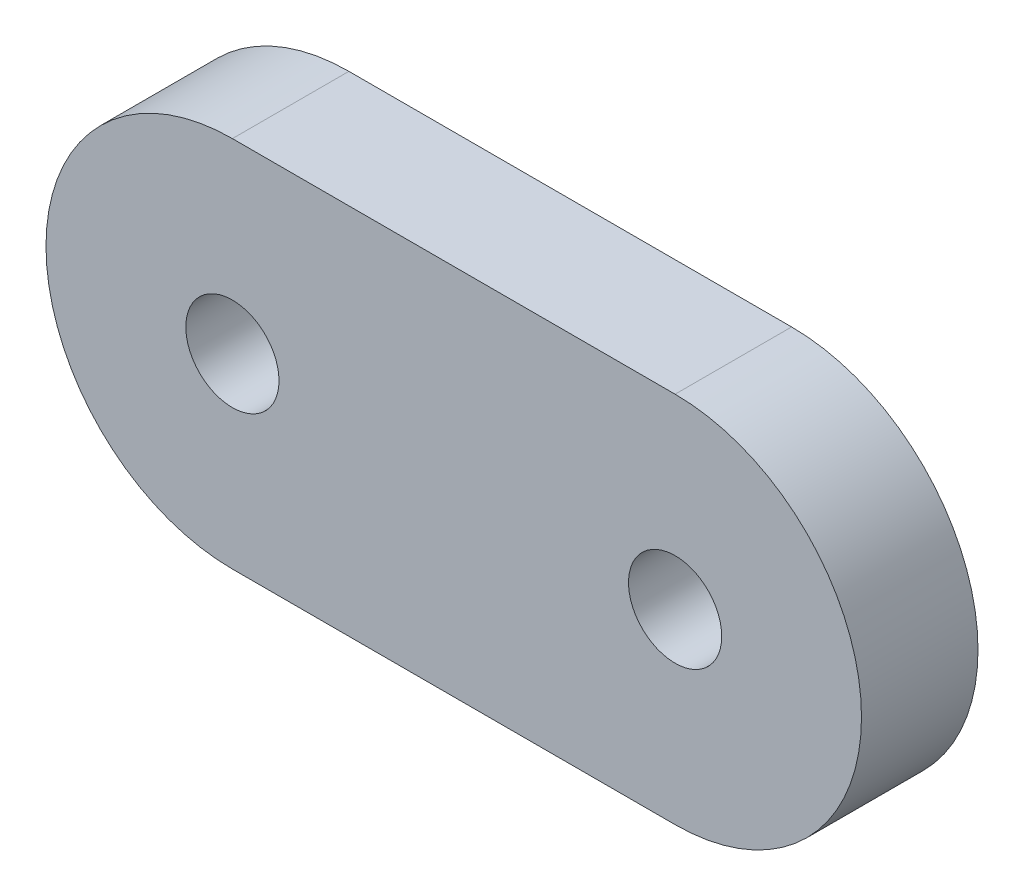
SolidWorks part; units mm, degrees
ref_plane "Front Plane" through (0, 0, 0) normal (0, 0, 1) x (1, 0, 0)
ref_plane "Top Plane" through (0, 0, 0) normal (0, 1, 0) x (1, 0, 0)
ref_plane "Right Plane" through (0, 0, 0) normal (1, 0, 0) x (0, 0, -1)
sketch "Sketch1" plane through (0, 0, 0) normal (0, 0, 1) x (1, 0, 0)
  line L0 (0, 0) -> (24.13, 0) construction
  line L1 (0, 10.16) -> (24.13, 10.16)
  line L2 (0, -10.16) -> (24.13, -10.16)
  line L3 (2.54, 0) -> (21.59, 0) construction
  arc A0 (0, 10.16) -> (0, -10.16) centre (0, 0) ccw
  arc A1 (24.13, -10.16) -> (24.13, 10.16) centre (24.13, 0) ccw
  circle A2 centre (0, 0) radius 2.54
  circle A3 centre (24.13, 0) radius 2.54
  point P3 (12.065, 0)
extrude "Boss-Extrude1" add sketch "Sketch1" along normal blind 6.35
equation "\"distance-between-holes\"= .75in"
equation "\"clamp-height\"= .8in"
equation "\"clamp-width\"= 1.5in"
equation "\"hole-diameter\"= .2in"
equation "\"material-thickness\"= .25in"
equation "\"D1@Boss-Extrude1\"=\"material-thickness\""
equation "\"D1@Sketch1\"=\"distance-between-holes\""
equation "\"D2@Sketch1\"=\"hole-diameter\""
equation "\"D3@Sketch1\"=\"hole-diameter\""
equation "\"D4@Sketch1\"=\"clamp-height\""
